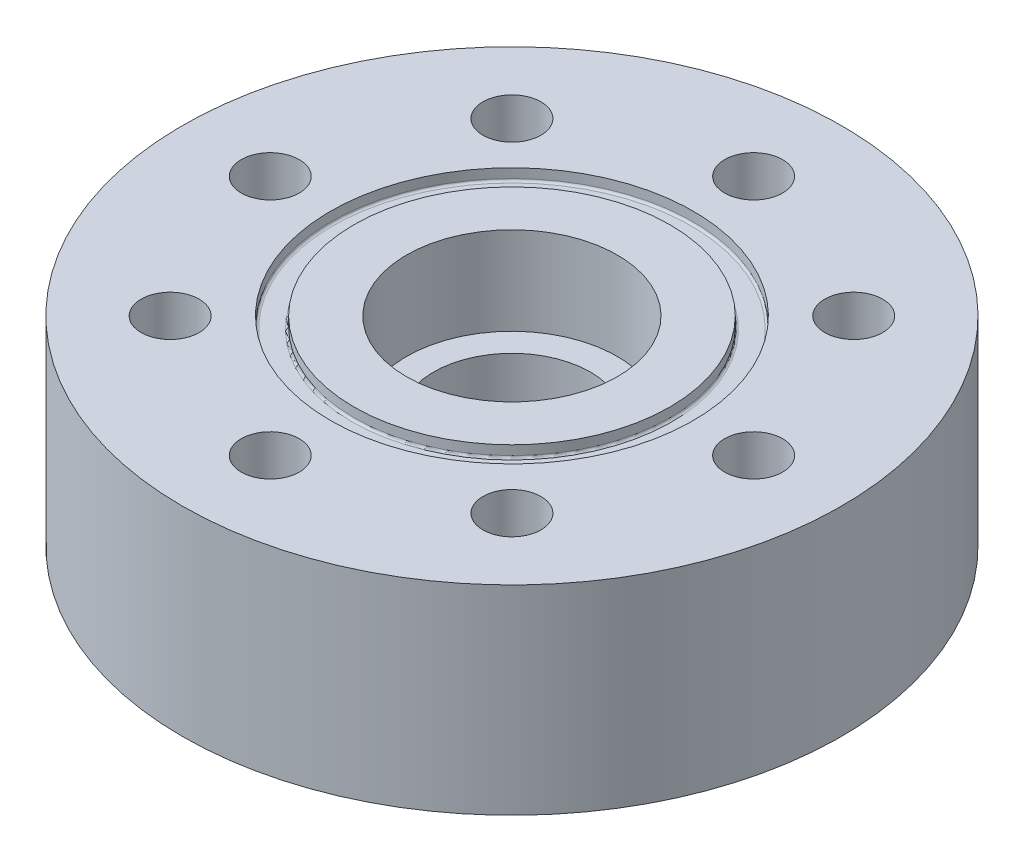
SolidWorks part; units mm, degrees
ref_plane "Front Plane" through (0, 0, 0) normal (0, 0, 1) x (1, 0, 0)
ref_plane "Top Plane" through (0, 0, 0) normal (0, 1, 0) x (1, 0, 0)
ref_plane "Right Plane" through (0, 0, 0) normal (1, 0, 0) x (0, 0, -1)
sketch "Sketch2" plane through (0, 0, 0) normal (0, 1, 0) x (1, 0, 0)
  circle A0 centre (0, 0) radius 37.5
  dimension "D1" = 75
extrude "Outer Cylinder" add sketch "Sketch2" along normal blind 22.7
sketch "Sketch3" plane through (0, 0, 0) normal (0, -1, 0) x (1, 0, 0)
  circle A0 centre (0, 0) radius 8.93
  dimension "D1" = 17.86
extrude "NPT Hole" cut sketch "Sketch3" against normal blind 12.7
sketch "Sketch4" plane through (0, 0, 0) normal (0, -1, 0) x (1, 0, 0)
  circle A0 centre (-27.5, 0) radius 3.3
  circle A1 centre (-19.4454, 19.4454) radius 3.3
  circle A2 centre (0, 27.5) radius 3.3
  circle A3 centre (19.4454, 19.4454) radius 3.3
  circle A4 centre (27.5, 0) radius 3.3
  circle A5 centre (19.4454, -19.4454) radius 3.3
  circle A6 centre (0, -27.5) radius 3.3
  circle A7 centre (-19.4454, -19.4454) radius 3.3
  point P19 (0, 0)
  dimension "D1" = 6.6
  dimension "D2" = 27.5
  dimension "D3" = 8
extrude "Bolt Holes" cut sketch "Sketch4" against normal through all
sketch "Sketch5" plane through (0, 22.7, 0) normal (0, 1, 0) x (1, 0, 0)
  circle A0 centre (0, 0) radius 17.9705
  circle A1 centre (0, 0) radius 20.6375
  dimension "D1" = 41.275
  dimension "D2" = 2.667
extrude "O-Ring Groove" cut sketch "Sketch5" against normal blind 1.3208
fillet "Fillet1" radius 0.254 2 edges at (0, 21.3792, 17.9705) (0, 21.3792, 20.6375)
sketch "Sketch6" plane through (0, 22.7, 0) normal (0, 1, 0) x (1, 0, 0)
  circle A0 centre (0, 0) radius 12
  dimension "D1" = 24
extrude "Inlet Flow Diameter" cut sketch "Sketch6" against normal blind 10
equation "\"D\"= 24"
equation "\"Inlet Flow Diameter\"= \"D\""
